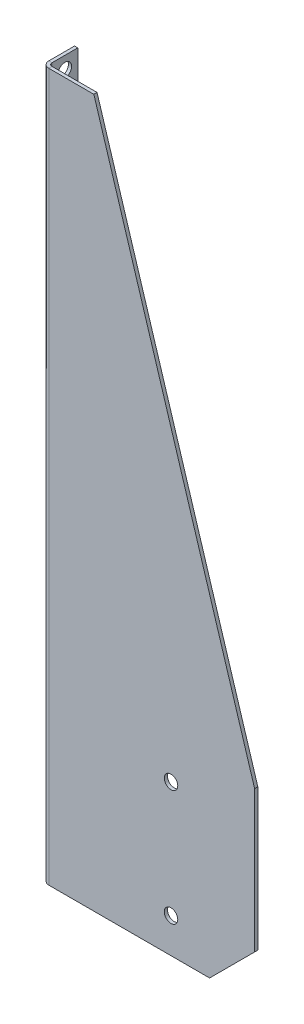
SolidWorks part; units mm, degrees
ref_plane "Plan de face" through (0, 0, 0) normal (0, 0, 1) x (1, 0, 0)
ref_plane "Plan de dessus" through (0, 0, 0) normal (0, 1, 0) x (1, 0, 0)
ref_plane "Plan de droite" through (0, 0, 0) normal (1, 0, 0) x (0, 0, -1)
mirrored part "RE030004_Rendre symétrique"
other "<RE030004>-<Dégagement M12>"
